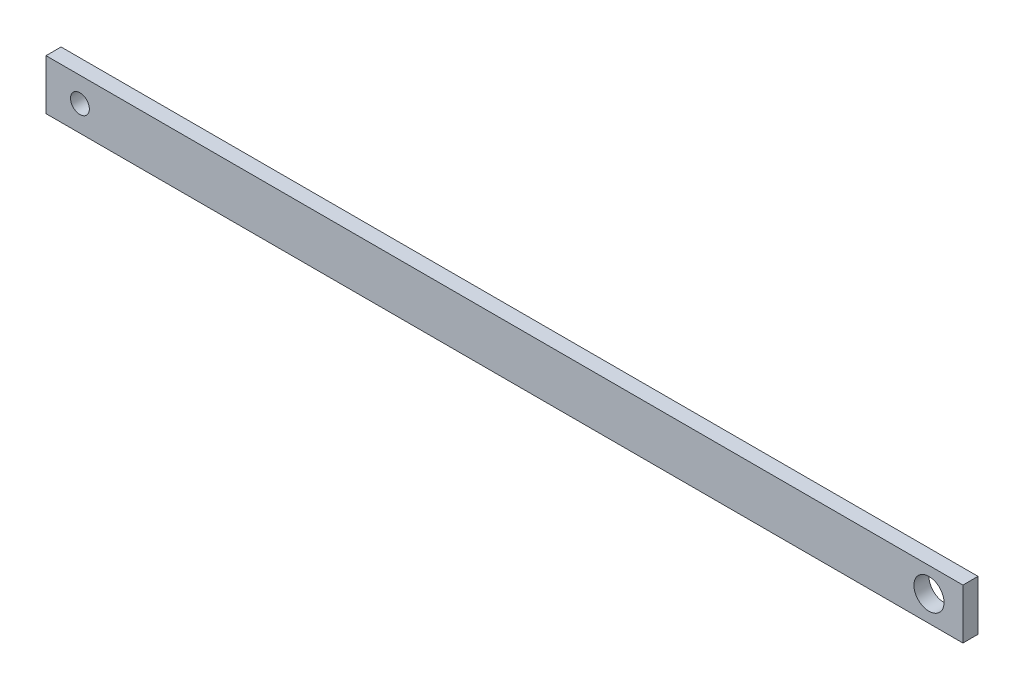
SolidWorks part; units mm, degrees
ref_plane "Front Plane" through (0, 0, 0) normal (0, 0, 1) x (1, 0, 0)
ref_plane "Top Plane" through (0, 0, 0) normal (0, 1, 0) x (1, 0, 0)
ref_plane "Right Plane" through (0, 0, 0) normal (1, 0, 0) x (0, 0, -1)
sketch "Sketch1" plane through (0, 0, 0) normal (0, 0, 1) x (1, 0, 0)
  line L1 (0, 0) -> (146, 0)
  line L2 (0, 0) -> (0, 8)
  line L3 (0, 8) -> (146, 8)
  line L4 (146, 0) -> (146, 8)
  dimension "D1" = 8
  dimension "D2" = 146
extrude "Boss-Extrude1" add sketch "Sketch1" along normal blind 2.4
sketch "Sketch2" plane through (0, 0, 2.4) normal (0, 0, 1) x (1, 0, 0)
  line L0 (0, 8) -> (0, 0) construction
  circle A0 centre (5.405, 4.0813) radius 1.5
  circle A1 centre (140.595, 4.0813) radius 2.4
  dimension "D3" = 3
  dimension "D4" = 4.8
  dimension "D1" = 135.19
  dimension "D2" = 5.405
extrude "Cut-Extrude1" cut sketch "Sketch2" against normal blind 2.4
